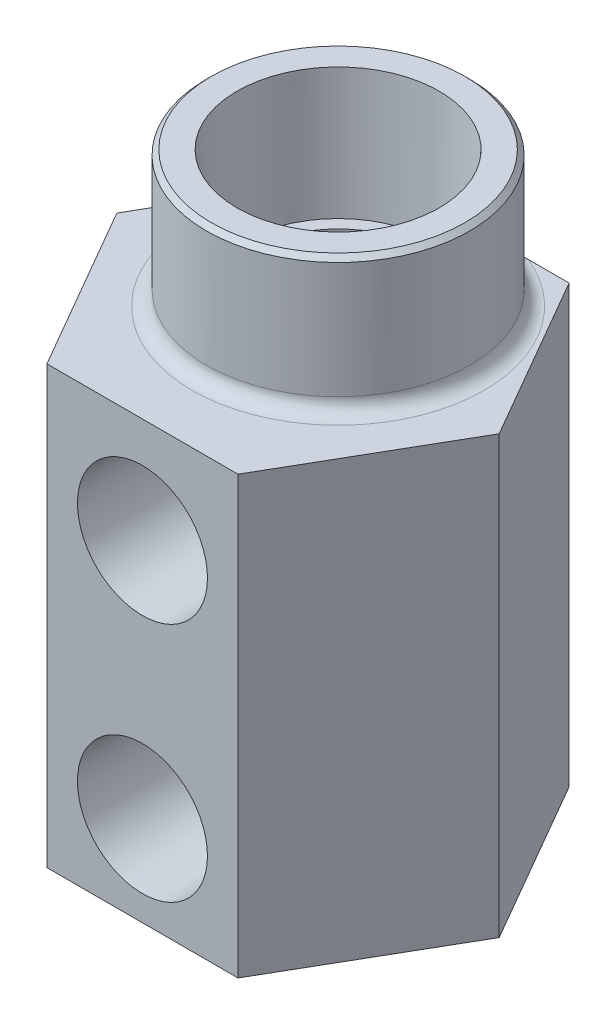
SolidWorks part; units mm, degrees
ref_plane "Front Plane" through (0, 0, 0) normal (0, 0, 1) x (1, 0, 0)
ref_plane "Top Plane" through (0, 0, 0) normal (0, 1, 0) x (1, 0, 0)
ref_plane "Right Plane" through (0, 0, 0) normal (1, 0, 0) x (0, 0, -1)
sketch "Sketch1" plane through (0, 0, 0) normal (0, 1, 0) x (1, 0, 0)
  line L1 (-10.082, -20.6375) -> (10.082, -20.6375)
  line L2 (10.082, -20.6375) -> (20.164, -3.175)
  line L3 (20.164, -3.175) -> (10.082, 14.2875)
  line L4 (10.082, 14.2875) -> (-10.082, 14.2875)
  line L5 (-10.082, 14.2875) -> (-20.164, -3.175)
  line L6 (-20.164, -3.175) -> (-10.082, -20.6375)
  circle A0 centre (0, -3.175) radius 17.4625 construction
  point P1 (65.8552, -0.0665)
  point P10 (9.0235, 0)
  point P11 (0, -3.2865)
  dimension "D1" = 34.925
  dimension "D2" = 3.175
extrude "Boss-Extrude1" add sketch "Sketch1" along normal blind 46.0248 separate body
sketch "Sketch2" plane through (0, 46.0248, 0) normal (0, 1, 0) x (1, 0, 0)
  circle A0 centre (0, 0) radius 13.8811
  circle A1 centre (0, -3.175) radius 17.4625 construction
  point P4 (0, 0)
  dimension "D1" = 27.7622
  dimension "D2" = 3.175
extrude "Boss-Extrude2" add sketch "Sketch2" along normal offset from surface (14.3002 mm away) 60.325
fillet "Fillet1" radius 1.524 1 edges at (0, 46.0248, 13.8811)
hole_wizard "1/4 NPT Tapped Hole1" positions "Sketch3" profile "Sketch4" size "1/4" standard "ANSI Inch"
sketch "Sketch3" plane through (0, 0, 20.6375) normal (0, 0, 1) x (1, 0, 0)
  point P0 (0, 9.525)
  dimension "D1" = 9.525
sketch "Sketch4" plane through (0, 9.525, 20.6375) normal (1, 0, 0) x (0, -1, 0)
  line L0 (0, 0) -> (0, 31.9173)
  line L1 (5.5626, 28.575) -> (0, 31.9173)
  line L2 (-5.5626, 28.575) -> (0, 31.9173) construction
  line L3 (5.5626, 28.575) -> (5.5626, 10.033)
  line L4 (5.5626, 10.033) -> (6.558, 10.033)
  line L5 (6.558, 10.033) -> (6.8584, 0)
  line L6 (-6.558, 10.033) -> (-6.8584, 0) construction
  line L7 (6.8584, 0) -> (0, 0)
  line L8 (0, -6.35) -> (0, 107.95) construction
  line L11 (-5.5626, 10.033) -> (-6.558, 10.033) construction
  dimension "Tap Drill Dia." = 11.1252
  dimension "Tap Drill Depth" = 28.575
  dimension "Thread Dia." = 13.7168
  dimension "Thread Angle" = 3.43
  dimension "Thread Depth" = 10.033
  dimension "Drill Angle" = 118
hole_wizard "1/4 NPT Tapped Hole2" positions "Sketch5" profile "Sketch6" size "1/4" standard "ANSI Inch"
sketch "Sketch5" plane through (0, 0, 20.6375) normal (0, 0, 1) x (1, 0, 0)
  circle A0 centre (0, 9.525) radius 6.8584 construction
  point P0 (0, 34.925)
  point P3 (0, 0)
  dimension "D1" = 25.4
sketch "Sketch6" plane through (0, 34.925, 20.6375) normal (1, 0, 0) x (0, -1, 0)
  line L0 (0, 0) -> (0, 20.4365)
  line L1 (5.5626, 17.0942) -> (0, 20.4365)
  line L2 (-5.5626, 17.0942) -> (0, 20.4365) construction
  line L3 (5.5626, 17.0942) -> (5.5626, 10.033)
  line L4 (5.5626, 10.033) -> (6.558, 10.033)
  line L5 (6.558, 10.033) -> (6.8584, 0)
  line L6 (-6.558, 10.033) -> (-6.8584, 0) construction
  line L7 (6.8584, 0) -> (0, 0)
  line L8 (0, -6.35) -> (0, 107.95) construction
  line L11 (-5.5626, 10.033) -> (-6.558, 10.033) construction
  dimension "Tap Drill Dia." = 11.1252
  dimension "Tap Drill Depth" = 17.0942
  dimension "Thread Dia." = 13.7168
  dimension "Thread Angle" = 3.43
  dimension "Thread Depth" = 10.033
  dimension "Drill Angle" = 118
hole_wizard "1/2 NPT Tapped Hole1" positions "Sketch7" profile "Sketch8" size "1/2" standard "ANSI Inch"
sketch "Sketch7" plane through (0, 60.325, 0) normal (0, 1, 0) x (1, 0, 0)
  point P0 (0, 0)
  point P3 (65.4348, 20.1658)
sketch "Sketch8" plane through (0, 60.325, 0) normal (1, 0, 0) x (0, 0, 1)
  line L0 (0, 0) -> (0, 34.5745)
  line L1 (8.9281, 29.21) -> (0, 34.5745)
  line L2 (-8.9281, 29.21) -> (0, 34.5745) construction
  line L3 (8.9281, 29.21) -> (8.9281, 13.5636)
  line L4 (8.9281, 13.5636) -> (10.2617, 13.5636)
  line L5 (10.2617, 13.5636) -> (10.6678, 0)
  line L6 (-10.2617, 13.5636) -> (-10.6678, 0) construction
  line L7 (10.6678, 0) -> (0, 0)
  line L8 (0, -6.35) -> (0, 107.95) construction
  line L11 (-8.9281, 13.5636) -> (-10.2617, 13.5636) construction
  dimension "Tap Drill Dia." = 17.8562
  dimension "Tap Drill Depth" = 29.21
  dimension "Thread Dia." = 21.3355
  dimension "Thread Angle" = 3.43
  dimension "Thread Depth" = 13.5636
  dimension "Drill Angle" = 118
sketch "Sketch9" plane through (0, 60.325, 0) normal (0, 1, 0) x (1, 0, 0)
  circle A0 centre (0, 0) radius 5.588
  dimension "D1" = 11.176
extrude "Cut-Extrude1" cut sketch "Sketch9" against normal blind 49.1998
chamfer "Chamfer1" distance 0.508 angle 45 1 edges at (0, 60.325, 13.8811)
